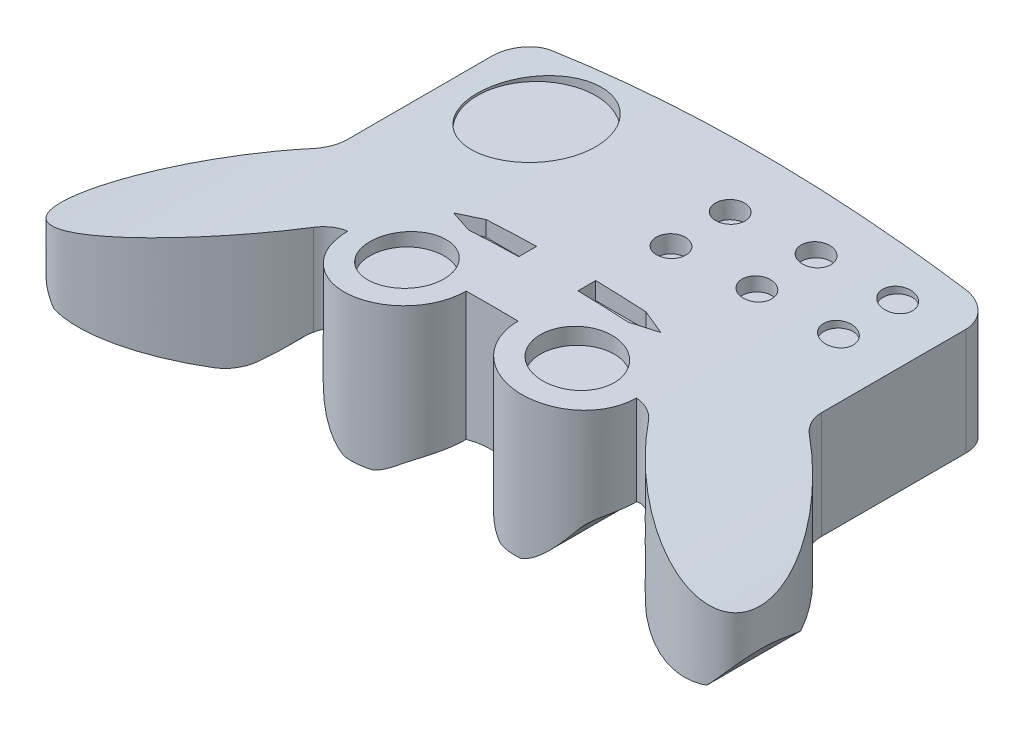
SolidWorks part; units mm, degrees
ref_plane "Front Plane" through (0, 0, 0) normal (0, 0, 1) x (1, 0, 0)
ref_plane "Top Plane" through (0, 0, 0) normal (0, 1, 0) x (1, 0, 0)
ref_plane "Right Plane" through (0, 0, 0) normal (1, 0, 0) x (0, 0, -1)
sketch "Sketch1" plane through (0, 0, 0) normal (0, 1, 0) x (1, 0, 0)
  line L0 (-80, -45) -> (80, 45) construction
  line L1 (70, 45) -> (-70, 45)
  line L2 (80, 35) -> (80, -13.7755)
  line L3 (8.7755, -45) -> (-8.7755, -45)
  line L4 (-80, 35) -> (-80, -13.7755)
  line L5 (-80, 45) -> (80, -45) construction
  line L6 (0, -92.6492) -> (0, 97.8479) construction
  arc A0 (-70, 45) -> (-80, 35) centre (-70, 35) ccw
  arc A1 (70, 45) -> (80, 35) centre (70, 35) cw
  arc A2 (83.7863, -21.6107) -> (80, -13.7755) centre (90, -13.7755) cw
  arc A3 (48.7755, -45) -> (56.6107, -48.7863) centre (48.7755, -55) cw
  arc A4 (-56.6107, -48.7863) -> (-48.7755, -45) centre (-48.7755, -55) cw
  arc A5 (-83.7863, -21.6107) -> (-80, -13.7755) centre (-90, -13.7755) ccw
  arc A6 (-48.7755, -45) -> (-8.7755, -45) centre (-28.7755, -45) ccw
  arc A7 (48.7755, -45) -> (8.7755, -45) centre (28.7755, -45) cw
  ellipse E0 centre (-80, -45) end of major axis (-115.3553, -80.3553) minor radius 20 (-83.7863, -21.6107) -> (-56.6107, -48.7863) ccw
  ellipse E1 centre (80, -45) end of major axis (115.3553, -80.3553) minor radius 20 (83.7863, -21.6107) -> (56.6107, -48.7863) cw
  dimension "D3" = 10
  dimension "D4" = 40
  dimension "D1" = 160
  dimension "D2" = 90
  dimension "D5" = 28.7755
  dimension "D6" = 44.6447
  dimension "D7" = 56.6107
extrude "Extrude1" add sketch "Sketch1" along normal mid plane 50
sketch "Sketch2" plane through (0, 0, 0) normal (0, 0, 1) x (1, 0, 0)
  line L2 (-118.0789, 25) -> (-118.0789, -25) construction
  spline S0 degree 2 poles (-118.0789, 10) (0, 40) (118.0789, 10) knots 0 0 0 1 1 1
  dimension "D1" = 10
  dimension "D2" = 118.0789
  dimension "D4" = 25
surface "Surface-Extrude1" sketch "Sketch2" parameters "D1"=170
other "SurfaceCut1"
sketch "Sketch3" plane through (0, 0, 0) normal (0, 0, 1) x (1, 0, 0)
  line L2 (-118.0789, 10) -> (-118.0789, -25) construction
  line L3 (-8.7755, -25) -> (8.7755, -25) construction
  line L4 (118.0789, -25) -> (118.0789, 10) construction
  spline S0 degree 2 poles (-118.0789, -10) (0, -40) (118.0789, -10) knots 0 0 0 1 1 1
  dimension "D1" = 10
surface "Surface-Extrude2" sketch "Sketch3" parameters "D1"=170
other "SurfaceCut2"
sketch "Sketch4" plane through (0, 0, 0) normal (0, 0, 1) x (1, 0, 0)
  line L0 (0, -59.3343) -> (0, 60.1039) construction
  line L3 (144.7715, 0) -> (-135.5968, 0) construction
  spline S0 degree 2 poles (-120, 0) (-85, -50) (-50, 0) knots 0 0 0 1 1 1
  spline S1 degree 2 poles (-50, 0) (-25, -50) (0, 0) knots 0 0 0 1 1 1
  spline S2 degree 2 poles (120, 0) (85, -50) (50, 0) knots 0 0 0 1 1 1
  spline S3 degree 2 poles (50, 0) (25, -50) (0, 0) knots 0 0 0 1 1 1
  dimension "D1" = 25
  dimension "D2" = 25
  dimension "D3" = 50
  dimension "D4" = 25
  dimension "D5" = 70
  dimension "D6" = 70
  dimension "D7" = 50
  dimension "D8" = 35
  dimension "D9" = 35
  dimension "D10" = 25
surface "Surface-Extrude3" sketch "Sketch4" parameters "D1"=170
other "SurfaceCut3"
fillet "Fillet3" radius 30 5 edges at (0, 0, 0) (11.1572, -17.3351, 54.4655)
fillet "Fillet4" radius 10 10 edges at (-53.776, -5.1032, 46.34) (-50, 0, 0.0376) (50, 0, 0.0376) (54.8551, -6.4548, 47.0603) (63.8077, -15.8344, 57.0432) (-44.5651, -9.6882, 57.2755)
ref_plane "Plane1" through (0, 25, 0) normal (0, 1, 0) x (-1, 0, 0)
sketch "Sketch5" plane through (0, 25, 0) normal (0, 1, 0) x (-1, 0, 0)
  line L0 (0, 74.8824) -> (0, -75.1381) construction
  line L1 (10, 20) -> (10, 26)
  line L2 (10, 26) -> (27, 26)
  line L3 (27, 26) -> (35, 23)
  line L4 (35, 23) -> (27, 20)
  line L5 (27, 20) -> (10, 20)
  line L6 (-27, 20) -> (-10, 20)
  line L7 (-35, 23) -> (-27, 20)
  line L8 (-27, 26) -> (-35, 23)
  line L9 (-10, 26) -> (-27, 26)
  line L10 (-10, 20) -> (-10, 26)
  line L11 (-12.5506, -22.8698) -> (-62.5506, -29.4404) construction
  line L12 (-12.5506, -2.8698) -> (-62.5506, -9.4404) construction
  circle A0 centre (50, -20) radius 20
  circle A1 centre (28.7755, 45) radius 12.5
  arc A2 (48.7755, 45) -> (8.7755, 45) centre (28.7755, 45) ccw construction
  circle A3 centre (-28.7755, 45) radius 12.5
  arc A4 (-8.7755, 45) -> (-48.7755, 45) centre (-28.7755, 45) ccw construction
  circle A5 centre (-38.1929, -26.2395) radius 5
  circle A6 centre (-12.5506, -22.8698) radius 5
  circle A7 centre (-62.5506, -29.4404) radius 5
  circle A8 centre (-12.5506, -2.8698) radius 5
  circle A9 centre (-38.1929, -6.2395) radius 5
  circle A10 centre (-62.5506, -9.4404) radius 5
  dimension "D1" = 40
  dimension "D4" = 25
  dimension "D5" = 25
  dimension "D12" = 50
  dimension "D13" = 10
  dimension "D14" = 12.5506
  dimension "D15" = 38.1929
  dimension "D2" = 20
  dimension "D3" = 50
  dimension "D6" = 6
  dimension "D7" = 25
  dimension "D8" = 17
  dimension "D9" = 20
  dimension "D10" = 3
  dimension "D11" = 10
  dimension "D16" = 2.8698
  dimension "D17" = 6.2395
  dimension "D18" = 22.8698
extrude "Extrude2" cut sketch "Sketch5" against normal blind 6
sketch "Sketch6" plane through (0, 0, -45) normal (0, 0, -1) x (-1, 0, 0)
  line L0 (0, -55.6327) -> (0, 77.2192) construction
  line L1 (20, 10) -> (50, 10)
  line L2 (-50, 20) -> (-20, 20)
  line L3 (-50, 20) -> (-50, 10)
  line L4 (-50, 10) -> (-20, 10)
  line L5 (-20, 20) -> (-20, 10)
  line L6 (20, 20) -> (20, 10)
  line L7 (20, 20) -> (50, 20)
  line L8 (50, 20) -> (50, 10)
  line L9 (-50, -5) -> (-20, -5)
  line L10 (-50, 5) -> (-50, -5)
  line L11 (-50, 5) -> (-20, 5)
  line L12 (-20, 5) -> (-20, -5)
  line L13 (20, -5) -> (50, -5)
  line L14 (20, 5) -> (20, -5)
  line L15 (20, 5) -> (50, 5)
  line L16 (50, 5) -> (50, -5)
  line L17 (-70, 19.7284) -> (-70, -19.7284) construction
  dimension "D1" = 30
  dimension "D2" = 10
  dimension "D3" = 20
  dimension "D4" = 10
  dimension "D5" = 90
  dimension "D6" = 14.7284
extrude "Extrude3" cut sketch "Sketch6" against normal blind 3
fillet "Fillet2" radius 10 8 edges at (-86.2277, -17.0009, 75.4174) (-69.1282, -19.8589, 8.6478) (69.1282, -19.8589, 8.6478) (76.3056, -18.7359, -42.7614)
